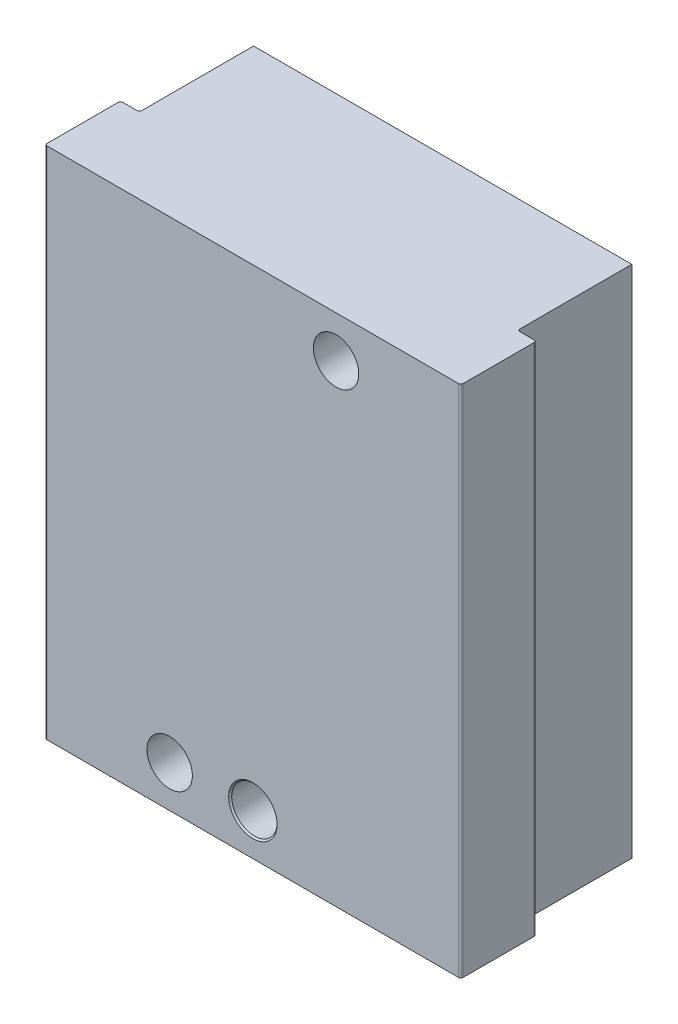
SolidWorks part; units mm, degrees
ref_plane "Plan de face" through (0, 0, 0) normal (0, 0, 1) x (1, 0, 0)
ref_plane "Plan de dessus" through (0, 0, 0) normal (0, 1, 0) x (1, 0, 0)
ref_plane "Plan de droite" through (0, 0, 0) normal (1, 0, 0) x (0, 0, -1)
sketch "Esquisse1" plane through (0, 0, 0) normal (0, 1, 0) x (1, 0, 0)
  line L0 (0, 0) -> (0, 25.1) construction
  line L1 (-25, 25.1) -> (25, 25.1)
  line L2 (-27.5, 10) -> (-27.5, 0)
  line L3 (-27.5, 0) -> (27.5, 0)
  line L4 (27.5, 10) -> (27.5, 0)
  line L8 (-27.5, 10) -> (-25, 10)
  line L9 (-25, 25.1) -> (-25, 10)
  line L12 (27.5, 10) -> (25, 10)
  line L13 (25, 25.1) -> (25, 10)
  dimension "D1" = 25.1
  dimension "D2" = 55
  dimension "D3" = 10
  dimension "D4" = 50
extrude "section profilé" add sketch "Esquisse1" along normal blind 68
fillet "Congé1" radius 0.3 6 edges at (27.5, 34, -10) (25, 34, -10) (-25, 34, -10) (-27.5, 34, -10) (27.5, 34, 0) (-27.5, 34, 0)
sketch "Esquisse3" plane through (0, 0, -25.1) normal (0, 0, -1) x (-1, 0, 0)
  line L0 (0, 0) -> (0, 68) construction
  line L1 (-25, 68) -> (25, 68) construction
  line L2 (-25, 0) -> (25, 0) construction
  circle A0 centre (0, 62.5) radius 3
  circle A1 centre (0, 5.5) radius 3
  dimension "D1" = 57
  dimension "D2" = 6
  dimension "D3" = 6
  dimension "D4" = 5.5
extrude "Enlèv. mat.-Extru.1" [suppressed] cut sketch "Esquisse3" against normal through all
sketch "Esquisse4" plane through (0, 0, -25.1) normal (0, 0, -1) x (-1, 0, 0)
  line L0 (-25, 0) -> (25, 0) construction
  circle A0 centre (-11, 62.5) radius 3
  circle A1 centre (11, 5.5) radius 3
  dimension "D1" = 11
  dimension "D2" = 11
  dimension "D5" = 6
  dimension "D3" = 57
  dimension "D4" = 5.5
extrude "Enlèv. mat.-Extru.2" cut sketch "Esquisse4" against normal through all
sketch "Esquisse5" [suppressed] plane through (0, 0, -25.1) normal (0, 0, -1) x (-1, 0, 0)
  line L0 (-25, 0) -> (25, 0) construction
  circle A0 centre (0, 30.5) radius 1.5
  dimension "D1" = 3
  dimension "D2" = 30.5
extrude "Enlèv. mat.-Extru.3" [suppressed] cut sketch "Esquisse5" against normal through all
sketch "Esquisse6" [suppressed] plane through (0, 0, 0) normal (0, 0, 1) x (1, 0, 0)
  circle A0 centre (0, 30.5) radius 3
  circle A1 centre (0, 30.5) radius 1.5 construction
  dimension "D1" = 6
extrude "Enlèv. mat.-Extru.4" [suppressed] cut sketch "Esquisse6" against normal blind 10
chamfer "Chanfrein1" [suppressed] distance 0.5 angle 45
sketch "Esquisse7" plane through (0, 0, -25.1) normal (0, 0, -1) x (-1, 0, 0)
  circle A0 centre (0, 5.5) radius 1.5
  dimension "D1" = 5.5
  dimension "D2" = 3
extrude "Enlèv. mat.-Extru.5" cut sketch "Esquisse7" against normal through all
sketch "Esquisse8" plane through (0, 0, 0) normal (0, 0, 1) x (1, 0, 0)
  circle A0 centre (0, 5.5) radius 3
  circle A1 centre (0, 5.5) radius 1.5 construction
  dimension "D1" = 6
extrude "Enlèv. mat.-Extru.6" cut sketch "Esquisse8" against normal blind 10
chamfer "Chanfrein2" distance 0.2 angle 45 1 edges at (3, 5.5, 0)
other "Empreinte1"
other "Eprouvette 3<2>@empreinte éprouvette1"
other "Eprouvette 3<1>@empreinte éprouvette1"
